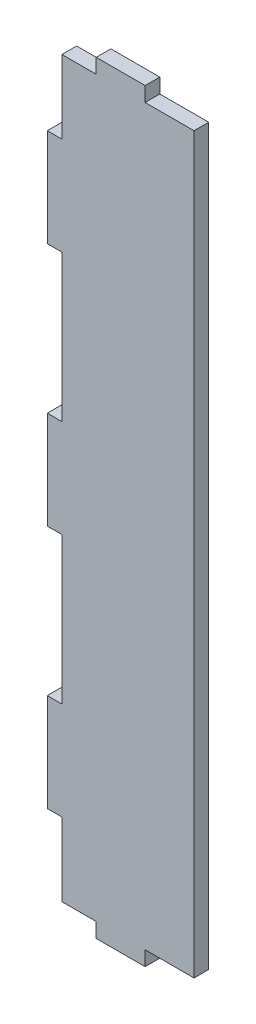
SolidWorks part; units mm, degrees
ref_plane "前视基准面" through (0, 0, 0) normal (0, 0, 1) x (1, 0, 0)
ref_plane "上视基准面" through (0, 0, 0) normal (0, 1, 0) x (1, 0, 0)
ref_plane "右视基准面" through (0, 0, 0) normal (1, 0, 0) x (0, 0, -1)
sketch "草图1" plane through (0, 0, 0) normal (0, 0, 1) x (1, 0, 0)
  line L1 (-15, -75) -> (15, -75)
  line L2 (-15, -75) -> (-15, 75)
  line L3 (-15, 75) -> (15, 75)
  line L4 (15, -75) -> (15, 75)
  line L5 (-15, -75) -> (15, 75) construction
  line L6 (-15, 75) -> (15, -75) construction
  point P0 (0, 0)
  dimension "D1" = 30
  dimension "D2" = 150
extrude "凸台-拉伸1" add sketch "草图1" along normal blind 3
sketch "草图2" plane through (0, 0, 0) normal (0, 0, 1) x (1, 0, 0)
  line L0 (0, 75) -> (0, -75) construction
  line L1 (15, 75) -> (-15, 75) construction
  line L2 (-15, -75) -> (15, -75) construction
  line L3 (-15, 0) -> (15, 0) construction
  line L4 (-5, 75) -> (5, 75)
  line L5 (-5, 75) -> (-5, 78)
  line L6 (-5, 78) -> (5, 78)
  line L7 (5, 75) -> (5, 78)
  line L8 (-15, 75) -> (-15, -75) construction
  line L9 (15, -75) -> (15, 75) construction
  line L10 (5, -75) -> (5, -78)
  line L11 (-5, -78) -> (5, -78)
  line L12 (-5, -75) -> (-5, -78)
  line L13 (-5, -75) -> (5, -75)
  dimension "D1" = 3
  dimension "D2" = 10
extrude "凸台-拉伸2" add sketch "草图2" along normal blind 3
sketch "草图3" plane through (0, 0, 3) normal (0, 0, 1) x (1, 0, 0)
  line L0 (-15, 0) -> (15, 0) construction
  line L1 (-15, 75) -> (-15, -75) construction
  line L2 (15, -75) -> (15, 75) construction
  line L3 (-12, -40) -> (-12, -10)
  line L4 (-15, 75) -> (-12, 75)
  line L5 (-15, 75) -> (-15, 60)
  line L6 (-15, 60) -> (-12, 60)
  line L7 (-12, 75) -> (-12, 60)
  line L8 (-15, 40) -> (-12, 40)
  line L9 (-15, 40) -> (-15, 10)
  line L10 (-15, 10) -> (-12, 10)
  line L11 (-12, 40) -> (-12, 10)
  line L12 (-15, -10) -> (-12, -10)
  line L13 (-15, -40) -> (-15, -10)
  line L14 (-15, -40) -> (-12, -40)
  line L15 (-12, -75) -> (-12, -60)
  line L16 (-15, -60) -> (-12, -60)
  line L17 (-15, -75) -> (-15, -60)
  line L18 (-15, -75) -> (-12, -75)
  dimension "D1" = 3
  dimension "D2" = 15
  dimension "D3" = 3
  dimension "D4" = 30
  dimension "D5" = 20
extrude "切除-拉伸1" cut sketch "草图3" against normal blind 3
